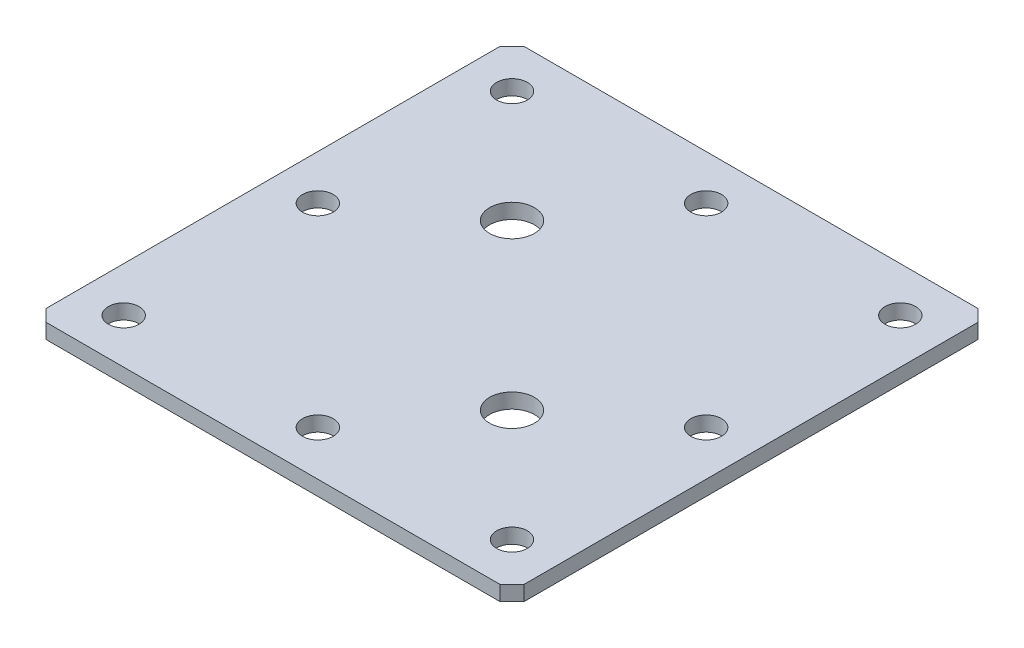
SolidWorks part; units mm, degrees
ref_plane "Front Plane" through (0, 0, 0) normal (0, 0, 1) x (1, 0, 0)
ref_plane "Top Plane" through (0, 0, 0) normal (0, 1, 0) x (1, 0, 0)
ref_plane "Right Plane" through (0, 0, 0) normal (1, 0, 0) x (0, 0, -1)
sketch "Sketch1" plane through (0, 0, 0) normal (0, 1, 0) x (1, 0, 0)
  line L0 (-57.4105, 21.9428) -> (-54.8705, 24.4828)
  line L1 (-54.8705, -77.1172) -> (41.6495, -77.1172)
  line L2 (-57.4105, -74.5772) -> (-57.4105, 21.9428)
  line L3 (-54.8705, 24.4828) -> (41.6495, 24.4828)
  line L4 (44.1895, -74.5772) -> (44.1895, 21.9428)
  line L5 (-57.4105, -77.1172) -> (44.1895, 24.4828) construction
  line L6 (-57.4105, 24.4828) -> (44.1895, -77.1172) construction
  line L7 (41.6495, 24.4828) -> (44.1895, 21.9428)
  line L8 (41.6495, -77.1172) -> (44.1895, -74.5772)
  line L9 (-57.4105, -74.5772) -> (-54.8705, -77.1172)
  line L10 (-47.8855, 14.9578) -> (-6.6105, 14.9578)
  line L11 (34.6645, -67.5922) -> (-47.8855, -67.5922) construction
  line L12 (34.6645, -67.5922) -> (34.6645, 14.9578) construction
  line L13 (34.6645, 14.9578) -> (-47.8855, 14.9578) construction
  line L14 (-47.8855, -67.5922) -> (-47.8855, 14.9578) construction
  line L15 (34.6645, -67.5922) -> (-47.8855, 14.9578) construction
  line L16 (34.6645, 14.9578) -> (-47.8855, -67.5922) construction
  line L17 (34.6645, -67.5922) -> (-6.6105, -67.5922)
  line L18 (-41.5355, -61.2422) -> (28.3145, -61.2422)
  line L19 (-41.5355, -61.2422) -> (-41.5355, 8.6078)
  line L20 (-41.5355, 8.6078) -> (28.3145, 8.6078)
  line L21 (28.3145, -61.2422) -> (28.3145, 8.6078)
  line L22 (-41.5355, -61.2422) -> (28.3145, 8.6078) construction
  line L23 (-41.5355, 8.6078) -> (28.3145, -61.2422) construction
  line L24 (-57.4105, -8.8547) -> (-24.073, -8.8547) construction
  line L25 (-24.073, -8.8547) -> (-24.073, 24.4828) construction
  line L26 (10.852, -77.1172) -> (10.852, -43.7797) construction
  line L27 (10.852, -43.7797) -> (44.1895, -43.7797) construction
  circle A0 centre (-47.8855, 14.9578) radius 3.2639
  circle A1 centre (-6.6105, 14.9578) radius 3.2639
  circle A2 centre (34.6645, 14.9578) radius 3.2639
  circle A3 centre (34.6645, -26.3172) radius 3.2639
  circle A4 centre (34.6645, -67.5922) radius 3.2639
  circle A5 centre (-6.6105, -67.5922) radius 3.2639
  circle A6 centre (-47.8855, -67.5922) radius 3.2639
  circle A7 centre (-47.8855, -26.3172) radius 3.2639
  circle A8 centre (-27.248, 14.9578) radius 4.7625 construction
  circle A9 centre (14.027, -67.5922) radius 4.7625 construction
  circle A10 centre (-24.073, -8.8547) radius 4.7625
  circle A11 centre (10.852, -43.7797) radius 4.7625
  point P0 (-6.6105, -26.3172)
  point P13 (-6.6105, -26.3172)
  point P34 (-6.6105, -26.3172)
  dimension "D13" = 6.5278
  dimension "D14" = 9.525
  dimension "D21" = 9.525
  dimension "D22" = 9.525
  dimension "D1" = 101.6
  dimension "D2" = 101.6
  dimension "D3" = 2.54
  dimension "D4" = 2.54
  dimension "D5" = 2.54
  dimension "D6" = 2.54
  dimension "D7" = 2.54
  dimension "D8" = 2.54
  dimension "D9" = 2.54
  dimension "D10" = 2.54
  dimension "D11" = 82.55
  dimension "D12" = 82.55
  dimension "D15" = 69.85
  dimension "D16" = 69.85
  dimension "D17" = 33.3375
  dimension "D18" = 33.3375
  dimension "D19" = 33.3375
  dimension "D20" = 33.3375
extrude "Boss-Extrude1" add sketch "Sketch1" along normal blind 3.175
